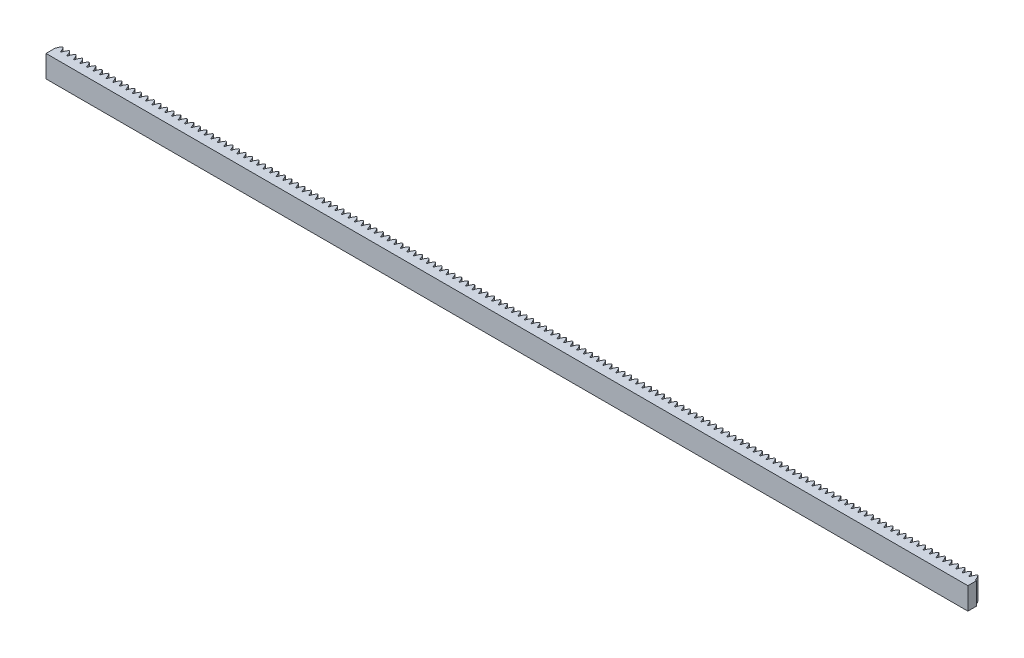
SolidWorks part; units mm, degrees
ref_plane "Front Plane" through (0, 0, 0) normal (0, 0, 1) x (1, 0, 0)
ref_plane "Top Plane" through (0, 0, 0) normal (0, 1, 0) x (1, 0, 0)
ref_plane "Right Plane" through (0, 0, 0) normal (1, 0, 0) x (0, 0, -1)
ref_plane "Plane1" through (0, 3.3284, -18.7393) normal (-1, 0, 0) x (0, 0, 1)
sketch "Sketch2" plane through (0, 10, 0) normal (0, 1, 0) x (1, 0, 0)
  line L0 (215, 18.7393) -> (0, 18.7393) construction
  line L1 (215, 18.7393) -> (0, 18.7393)
  line L2 (0.5903, 21.9961) -> (0.7413, 21.9961)
  line L3 (0, 18.7393) -> (215, 18.7393)
  line L4 (0, 18.7393) -> (0, 20.7393)
  line L5 (0, 20.7393) -> (215, 20.7393)
  line L6 (215, 18.7393) -> (215, 20.7393)
  line L7 (0, 20.7393) -> (1.3319, 20.7393)
  arc A0 (0, 20.7393) -> (0.7455, 22.1754) centre (2.9362, 20.1267) cw
  arc A1 (1.3319, 20.7393) -> (0.7413, 21.9961) centre (-1.6043, 20.1267) ccw
  dimension "D1" = 2
extrude "Boss-Extrude1" add sketch "Sketch2" along normal mid plane 5.15 contours L1 L6 L5 L4
sketch "Sketch3" plane through (0, 7.425, 0) normal (0, -1, 0) x (1, 0, 0)
  line L0 (0.5903, -21.9961) -> (0.7413, -21.9961) construction
  line L1 (0, -20.7393) -> (1.3319, -20.7393) construction
  line L2 (215, -18.7393) -> (0, -18.7393) construction
  line L3 (0, -18.7393) -> (215, -18.7393) construction
  line L4 (0, -18.7393) -> (0, -20.7393) construction
  line L5 (0, -20.7393) -> (215, -20.7393) construction
  line L6 (215, -18.7393) -> (215, -20.7393) construction
  line L7 (0.5903, -21.9961) -> (0.7413, -21.9961)
  line L8 (0, -20.7393) -> (1.3319, -20.7393)
  line L9 (215, -18.7393) -> (0, -18.7393)
  line L10 (0, -18.7393) -> (215, -18.7393)
  line L11 (0, -18.7393) -> (0, -20.7393)
  line L12 (0, -20.7393) -> (215, -20.7393)
  line L13 (215, -18.7393) -> (215, -20.7393)
  arc A0 (0.7413, -21.9961) -> (1.3319, -20.7393) centre (-1.6043, -20.1267) ccw construction
  arc A1 (0, -20.7393) -> (0.7455, -22.1754) centre (2.9362, -20.1267) ccw construction
  arc A2 (0.7413, -21.9961) -> (1.3319, -20.7393) centre (-1.6043, -20.1267) ccw
  arc A3 (0, -20.7393) -> (0.7455, -22.1754) centre (2.9362, -20.1267) ccw
extrude "Boss-Extrude2" add sketch "Sketch3" against normal up to surface (5.15 mm away) contours A3 L7 A2 M3
fillet "Fillet1" radius 0.1 1 edges at (1.3319, 10, -20.7393)
pattern_linear "LPattern1" count 141 spacing 1.524 along (1, 0, 0) of "Boss-Extrude2", "Fillet1"
fillet "Fillet2" radius 0.1 1 edges at (1.524, 10, -20.7393)
